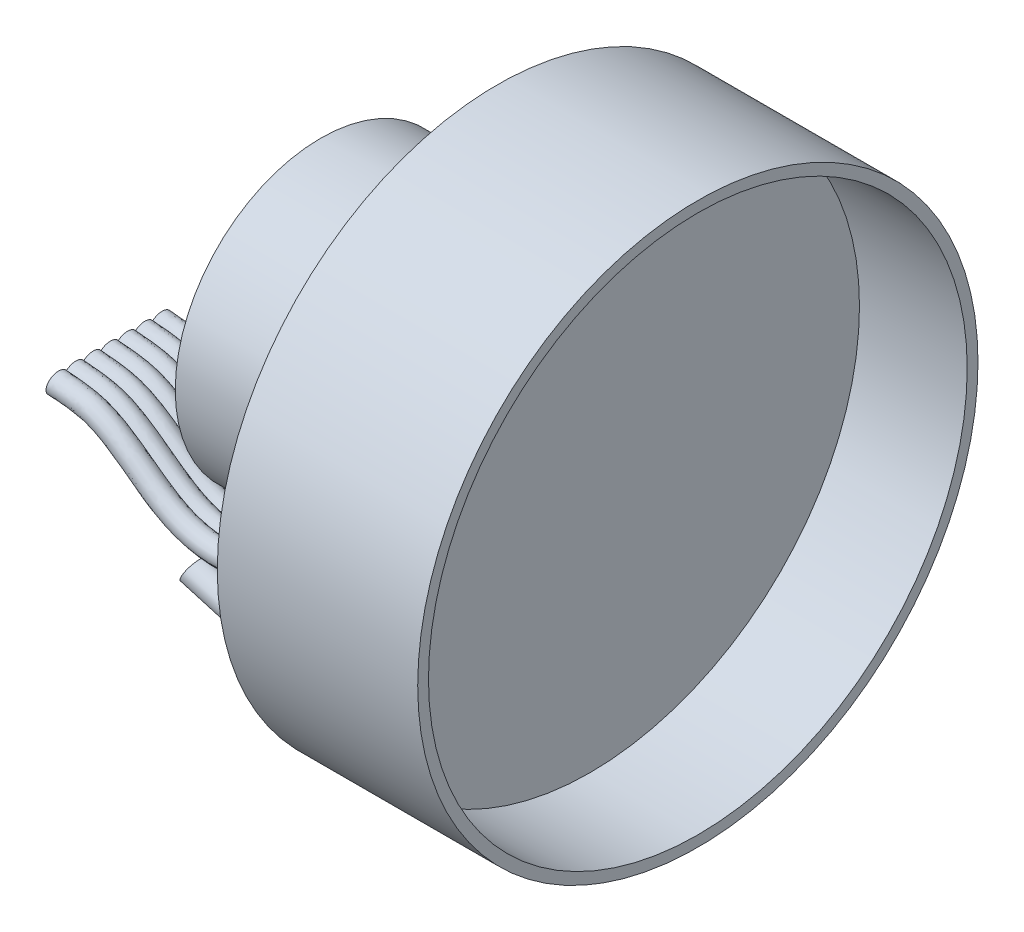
SolidWorks part; units mm, degrees
ref_plane "Face" through (0, 0, 0) normal (0, 0, 1) x (1, 0, 0)
ref_plane "Dessus" through (0, 0, 0) normal (0, 1, 0) x (1, 0, 0)
ref_plane "Droite" through (0, 0, 0) normal (1, 0, 0) x (0, 0, -1)
sketch "Esquisse1" plane through (0, 0, 0) normal (0, 0, 1) x (1, 0, 0)
  line L0 (0, 0) -> (56.5227, 0) construction
  line L1 (0, 0) -> (0, 6.75)
  line L2 (0, 6.75) -> (4.5, 6.75)
  line L3 (4.5, 6.75) -> (5.5, 7.75)
  line L4 (5.5, 7.75) -> (8.2, 7.75)
  line L5 (8.2, 7.75) -> (8.2, 13)
  line L6 (8.2, 13) -> (17.5, 13)
  line L7 (17.5, 13) -> (17.5, 12.5)
  line L8 (17.5, 12.5) -> (12.5, 12.5)
  line L9 (12.5, 12.5) -> (12.5, 0)
  line L10 (0, 0) -> (12.5, 0)
  dimension "D1" = 13.5
  dimension "D2" = 15.5
  dimension "D3" = 25
  dimension "D4" = 26
  dimension "D5" = 5
  dimension "D6" = 9.3
  dimension "D7" = 45
  dimension "D8" = 8.2
  dimension "D9" = 4.5
revolve "Révolution1" add sketch "Esquisse1" angle 360 about L0
sketch "Esquisse2" plane through (0, 0, 0) normal (-1, 0, 0) x (0, 0, 1)
  line L0 (-4.5346, -5) -> (4.5346, -5)
  circle A1 centre (0, 0) radius 6.75
  arc A2 (-4.5346, -5) -> (4.5346, -5) centre (0, 0) ccw
  dimension "D2" = 5
  dimension "D1" = 0
extrude "Enlèv. mat.-Extru.1" cut sketch "Esquisse2" against normal blind 2.5
sketch "Esquisse3" plane through (0, 0, 0) normal (0, 0, 1) x (1, 0, 0)
  line L0 (2.5, -5) -> (0, -5) construction
  spline_without_curve S0
  point P0 (1.7, -5)
  dimension "D1" = 1.7
sketch "Esquisse4" plane through (0, 0, 0) normal (0, 0, 1) x (1, 0, 0)
  line L0 (8.2, 13) -> (8.2, -13) construction
  line L2 (8.2, -13) -> (17.5, -13) construction
  spline_without_curve S0
  point P0 (10.2, -13)
  dimension "D1" = 2
sketch "Esquisse5" plane through (0, -5, 0) normal (0, -1, 0) x (1, 0, 0)
  arc A0 (1.4, 0.4) -> (1.4, -0.4) centre (1.7, 0) ccw
  arc A1 (1.4, -0.4) -> (1.4, -1.2) centre (1.7, -0.8) ccw
  arc A2 (1.4, -1.2) -> (1.4, -2) centre (1.7, -1.6) ccw
  arc A3 (1.4, -2) -> (2, -2) centre (1.7, -2.4) ccw
  arc A4 (1.4, 1.2) -> (1.4, 0.4) centre (1.7, 0.8) ccw
  arc A5 (1.4, 2) -> (1.4, 1.2) centre (1.7, 1.6) ccw
  arc A6 (2, 2) -> (1.4, 2) centre (1.7, 2.4) ccw
  arc A7 (2, 1.2) -> (2, 2) centre (1.7, 1.6) ccw
  arc A8 (2, 0.4) -> (2, 1.2) centre (1.7, 0.8) ccw
  arc A9 (2, -0.4) -> (2, 0.4) centre (1.7, 0) ccw
  arc A10 (2, -1.2) -> (2, -0.4) centre (1.7, -0.8) ccw
  arc A11 (2, -2) -> (2, -1.2) centre (1.7, -1.6) ccw
  dimension "D1" = 1
  dimension "D2" = 0.8
  dimension "D3" = 0.8
  dimension "D4" = 0.8
  dimension "D5" = 0.8
  dimension "D6" = 0.8
  dimension "D7" = 0.8
sweep "Balayage1" add profiles "Esquisse5" path "Esquisse3"
ref_plane "Plan1" through (0, -13, 0) normal (0, 1, 0) x (-1, 0, 0)
sketch "Esquisse6" plane through (0, -13, 0) normal (0, 1, 0) x (-1, 0, 0)
  arc A0 (-10.5317, 0) -> (-9.8683, 0) centre (-10.2, -0.5) ccw
  arc A1 (-9.8683, 0) -> (-10.5317, 0) centre (-10.2, 0.5) ccw
  dimension "D1" = 1.2
  dimension "D2" = 0.5
  dimension "D3" = 0.5
sweep "Balayage2" add profiles "Esquisse6" path "Esquisse4"
